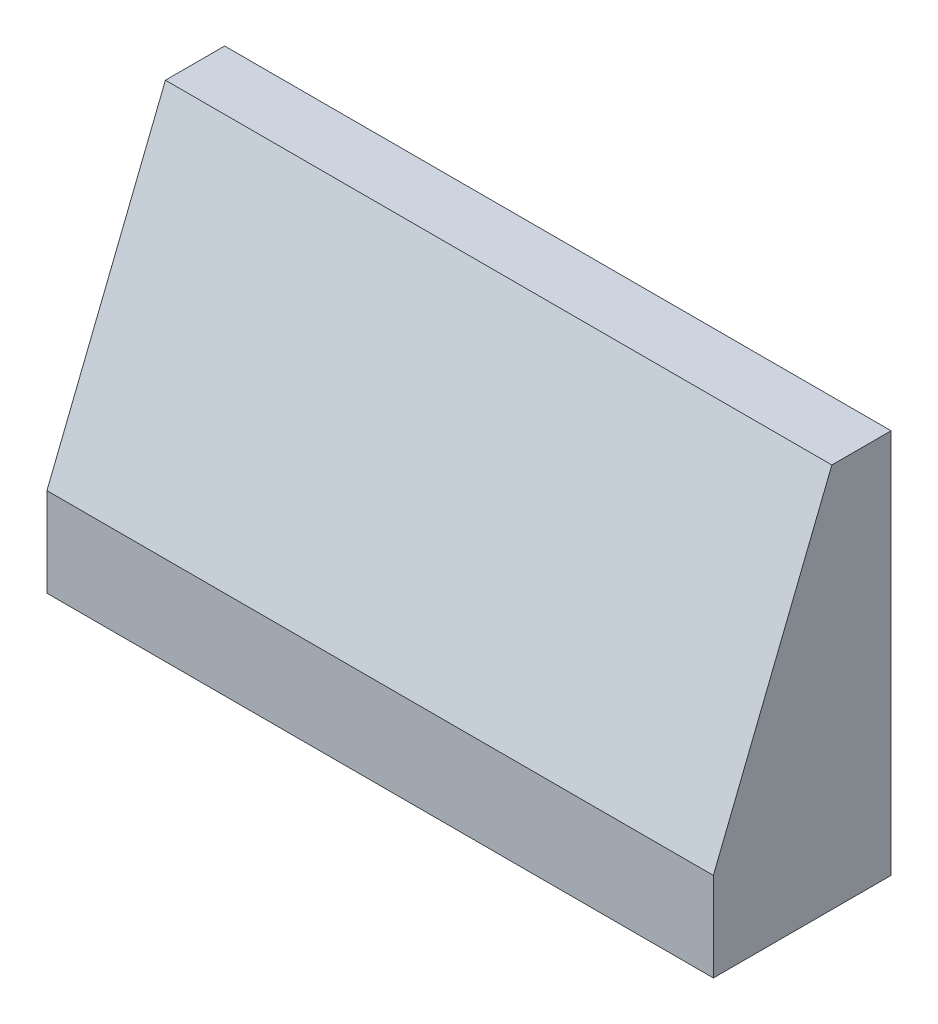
SolidWorks part; units mm, degrees
ref_plane "Front Plane" through (0, 0, 0) normal (0, 0, 1) x (1, 0, 0)
ref_plane "Top Plane" through (0, 0, 0) normal (0, 1, 0) x (1, 0, 0)
ref_plane "Right Plane" through (0, 0, 0) normal (1, 0, 0) x (0, 0, -1)
sketch "Sketch2" plane through (0, 0, 0) normal (1, 0, 0) x (0, 0, -1)
  line L0 (12, 6) -> (12, 26)
  line L1 (0, 0) -> (12, 0)
  line L2 (0, 0) -> (0, 6)
  line L3 (0, 6) -> (12, 6) construction
  line L4 (12, 0) -> (12, 6)
  line L5 (12, 26) -> (8, 26)
  line L6 (8, 26) -> (0, 6)
  dimension "D1" = 12
  dimension "D2" = 6
  dimension "D3" = 20
  dimension "D4" = 4
extrude "Boss-Extrude1" add sketch "Sketch2" against normal blind 45
sketch "Sketch3" plane through (0, 0, 0) normal (0, -1, 0) x (1, 0, 0)
  line L0 (-22.5, -6) -> (0, -6) construction
  line L1 (-45, 0) -> (-45, -12) construction
  line L2 (0, 0) -> (0, -12) construction
  line L3 (-22.5, 0) -> (-22.5, -12) construction
  line L4 (-45, 0) -> (0, 0) construction
  line L5 (-45, -12) -> (0, -12) construction
  line L6 (-45, -6) -> (-22.5, -6) construction
  circle A0 centre (-33.75, -6) radius 4
  circle A1 centre (-11.25, -6) radius 4
  point P15 (-22.5, -6)
  dimension "D1" = 8
  dimension "D2" = 8
extrude "Cut-Extrude1" cut sketch "Sketch3" against normal blind 5
